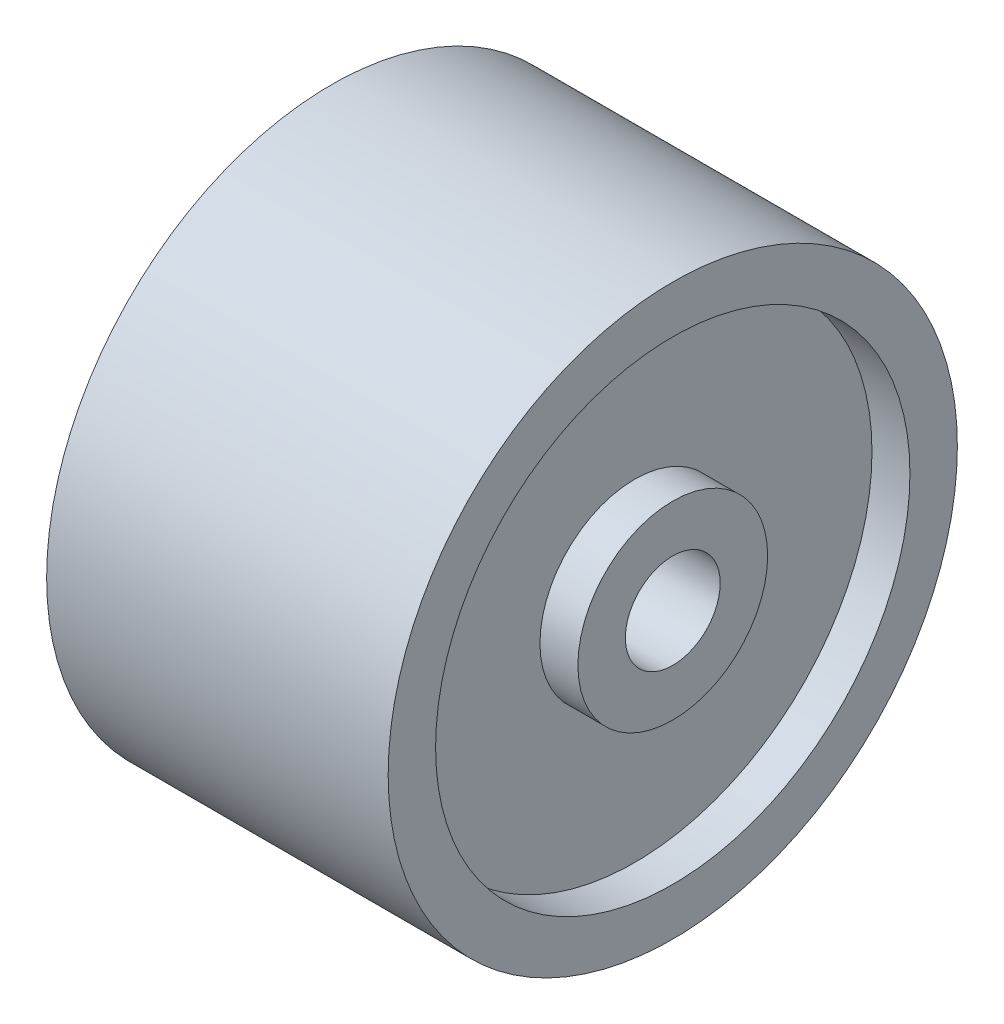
SolidWorks part; units mm, degrees
ref_plane "Front Plane" through (0, 0, 0) normal (0, 0, 1) x (1, 0, 0)
ref_plane "Top Plane" through (0, 0, 0) normal (0, 1, 0) x (1, 0, 0)
ref_plane "Right Plane" through (0, 0, 0) normal (1, 0, 0) x (0, 0, -1)
sketch "Sketch1" plane through (0, 0, 0) normal (1, 0, 0) x (0, 0, -1)
  circle A0 centre (0, 0) radius 19.05
  circle A1 centre (0, 0) radius 3.175
  dimension "D1" = 38.1
  dimension "D2" = 6.35
extrude "Extrude1" add sketch "Sketch1" along normal mid plane 22.86
sketch "Sketch2" plane through (11.43, 0, 0) normal (1, 0, 0) x (0, 0, -1)
  circle A0 centre (0, 0) radius 15.875
  circle A1 centre (0, 0) radius 6.35
  dimension "D1" = 31.75
  dimension "D2" = 12.7
extrude "Extrude2" cut sketch "Sketch2" against normal blind 2.54
mirror "Mirror1" about plane through (0, 0, 0) normal (1, 0, 0) of "Extrude2"
